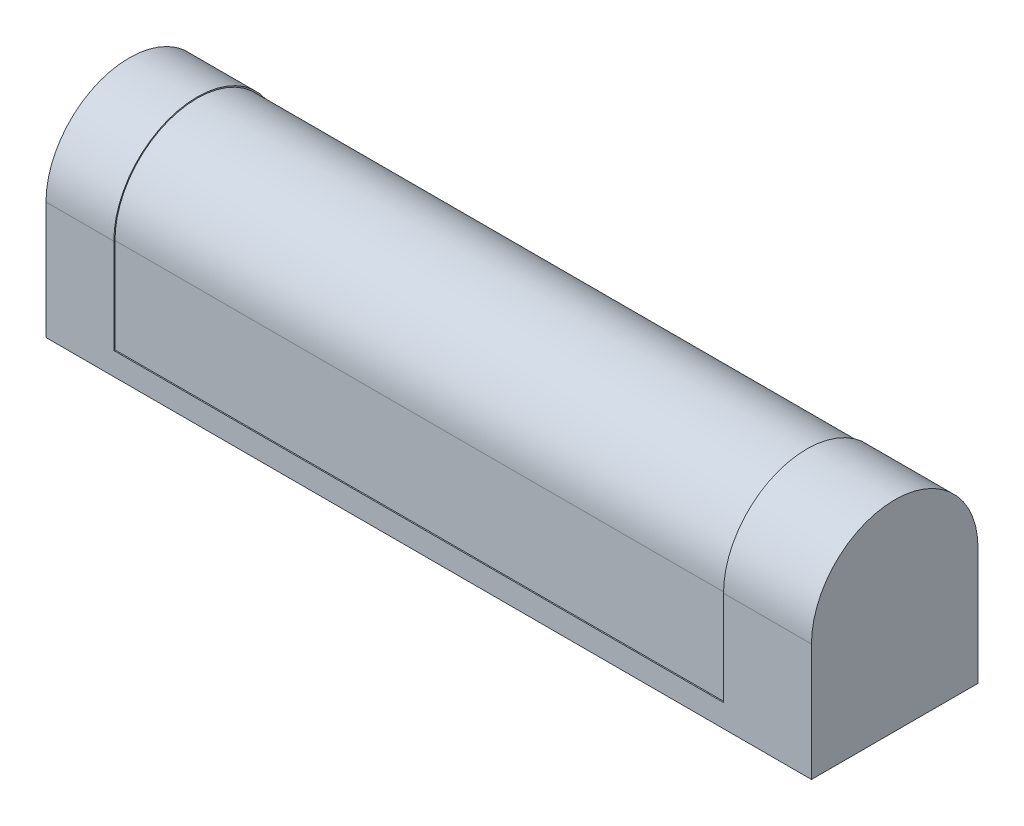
SolidWorks part; units mm, degrees
ref_plane "Front Plane" through (0, 0, 0) normal (0, 0, 1) x (1, 0, 0)
ref_plane "Top Plane" through (0, 0, 0) normal (0, 1, 0) x (1, 0, 0)
ref_plane "Right Plane" through (0, 0, 0) normal (1, 0, 0) x (0, 0, -1)
sketch "Sketch1" plane through (0, 0, 0) normal (1, 0, 0) x (0, 0, -1)
  line L0 (0, 31) -> (-45.7292, 31) construction
  line L2 (-31, 0) -> (-31, -43.7)
  line L3 (-31, -43.7) -> (31, -43.7)
  line L4 (31, 0) -> (31, -43.7)
  arc A0 (31, 0) -> (-31, 0) centre (0, 0) ccw
  dimension "D1" = 62
  dimension "D2" = 74.7
extrude "Boss-Extrude1" add sketch "Sketch1" along normal blind 285
ref_plane "Plane1" through (25.25, 0, 0) normal (-1, 0, 0) x (0, 0, 1)
sketch "Sketch2" plane through (25.25, 0, 0) normal (-1, 0, 0) x (0, 0, 1)
  line L1 (-37.5578, 31.5367) -> (33.8744, 31.5367)
  line L2 (-30.5682, 0) -> (-30.5682, -38.3169)
  line L3 (-30.5682, -38.3169) -> (30.5682, -38.3169)
  line L4 (30.5682, 0) -> (30.5682, -38.3169)
  line L5 (-37.5578, 31.5367) -> (-37.5578, -46.3415)
  line L6 (-37.5578, -46.3415) -> (33.8744, -46.3415)
  line L7 (33.8744, 31.5367) -> (33.8744, -46.3415)
  arc A0 (30.5682, 0) -> (-30.5682, 0) centre (0, 0) ccw
extrude "Cut-Extrude1" cut sketch "Sketch2" against normal blind 227
sketch "Sketch3" plane through (25.25, 0, 0) normal (1, 0, 0) x (0, 0, -1)
  line L1 (31, -43.7) -> (-30.5682, -43.7)
  line L2 (31, -43.7) -> (31, -38.3169)
  line L3 (31, -38.3169) -> (-30.5682, -38.3169)
  line L4 (-30.5682, -43.7) -> (-30.5682, -38.3169)
extrude "Boss-Extrude2" add sketch "Sketch3" along normal blind 227
sketch "Sketch4" plane through (0, 0, 30.5682) normal (0, 0, 1) x (1, 0, 0)
  line L0 (25.25, 34.1) -> (25.25, -34.1) construction
  line L1 (252.25, -43.7) -> (25.25, -43.7)
  line L2 (252.25, -43.7) -> (252.25, -35.2612)
  line L3 (252.25, -35.2612) -> (25.25, -35.2612)
  line L4 (25.25, -43.7) -> (25.25, -35.2612)
extrude "Boss-Extrude3" add sketch "Sketch4" along normal up to surface (0.4318 mm away)
sketch "Sketch5" plane through (0, -43.7, 0) normal (0, -1, 0) x (1, 0, 0)
  line L1 (285, 31) -> (0, 31) construction
  line L2 (285, -31) -> (0, -31) construction
  circle A0 centre (5.975, 25.4) radius 4
  circle A1 centre (5.975, -25.4) radius 4
  circle A2 centre (279.025, 25.4) radius 4
  circle A3 centre (279.025, -25.4) radius 4
  point P8 (142.5, 31)
  point P13 (142.5, -31)
  dimension "D1" = 8
  dimension "D2" = 8
  dimension "D3" = 8
  dimension "D4" = 8
  dimension "D5" = 50.8
  dimension "D6" = 25.4
  dimension "D7" = 50.8
  dimension "D8" = 25.4
  dimension "D9" = 273.05
  dimension "D10" = 273.05
  dimension "D11" = 136.525
  dimension "D12" = 136.525
extrude "Cut-Extrude2" cut sketch "Sketch5" against normal blind 10
